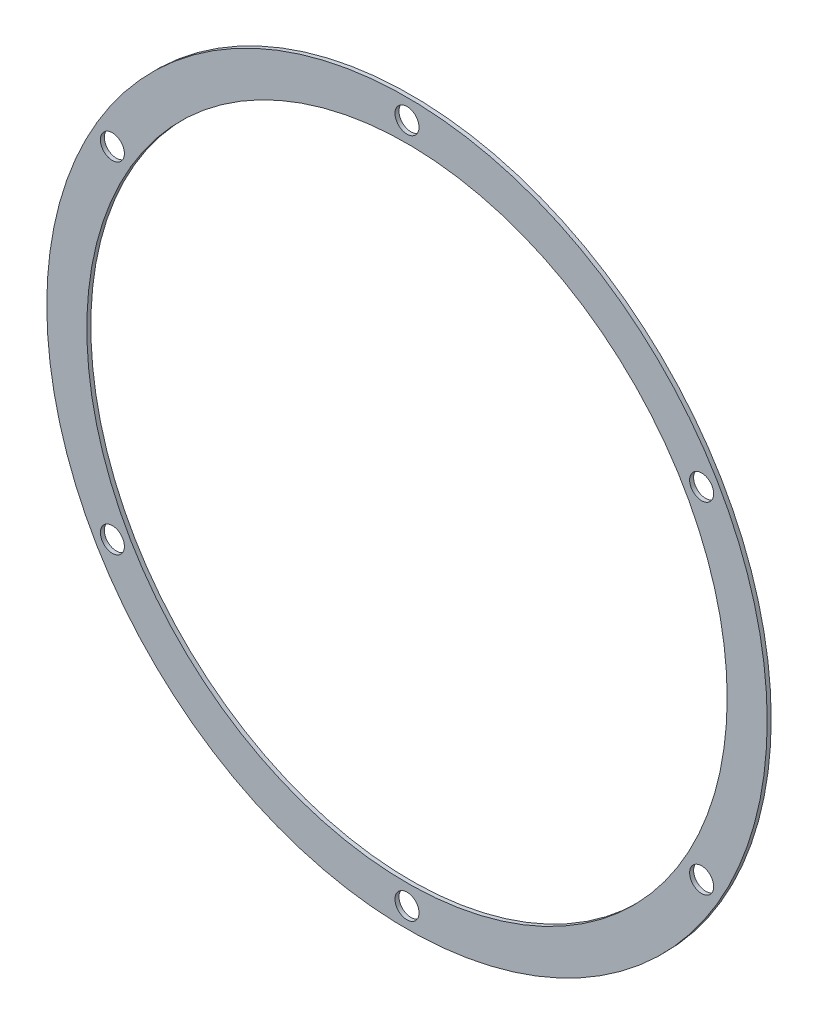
SolidWorks part; units mm, degrees
ref_plane "Front Plane" through (0, 0, 0) normal (0, 0, 1) x (1, 0, 0)
ref_plane "Top Plane" through (0, 0, 0) normal (0, 1, 0) x (1, 0, 0)
ref_plane "Right Plane" through (0, 0, 0) normal (1, 0, 0) x (0, 0, -1)
sketch "Sketch1" plane through (0, 0, 0) normal (0, 0, 1) x (1, 0, 0)
  circle A0 centre (0, 0) radius 160
  circle A1 centre (0, 0) radius 180
  dimension "D1" = 320
  dimension "D2" = 360
extrude "Boss-Extrude1" add sketch "Sketch1" along normal blind 2
sketch "Sketch2" plane through (0, 0, 2) normal (0, 0, 1) x (1, 0, 0)
  circle A0 centre (0, 0) radius 170 construction
  circle A1 centre (0, 170) radius 6
  dimension "D1" = 340
  dimension "D2" = 12
extrude "Cut-Extrude1" cut sketch "Sketch2" against normal through all
pattern_circular "CirPattern1" count 6 over 360 about axis through (0, 0, 0) along (0, 0, 1) of "Cut-Extrude1"
